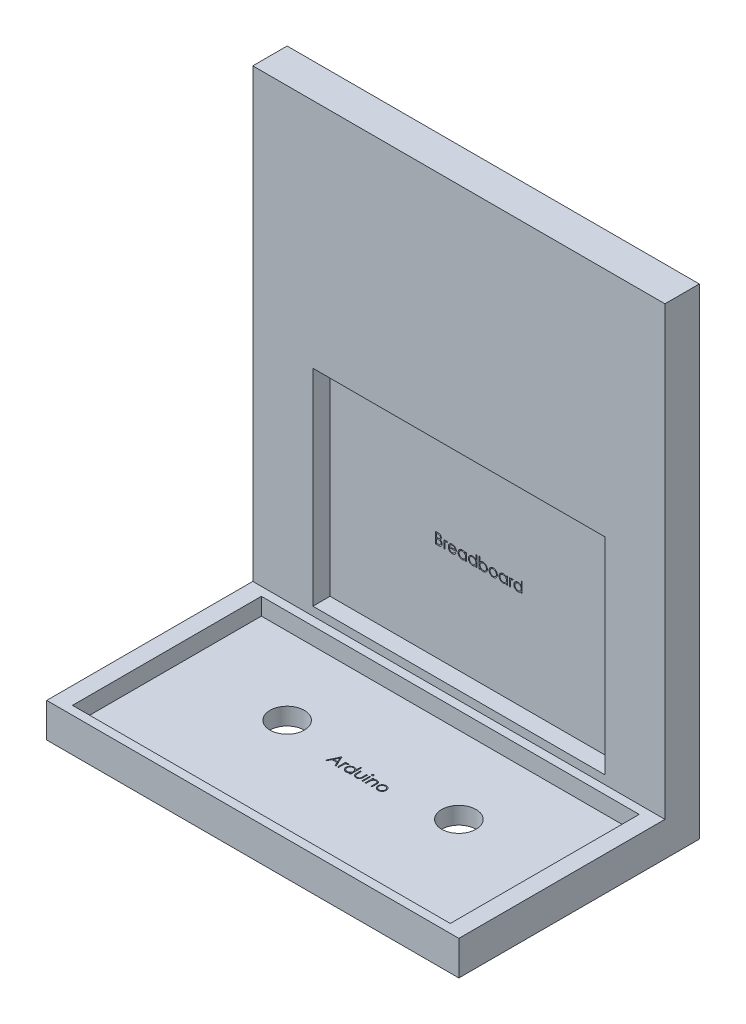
SolidWorks part; units mm, degrees
ref_plane "Front Plane" through (0, 0, 0) normal (0, 0, 1) x (1, 0, 0)
ref_plane "Top Plane" through (0, 0, 0) normal (0, 1, 0) x (1, 0, 0)
ref_plane "Right Plane" through (0, 0, 0) normal (1, 0, 0) x (0, 0, -1)
sketch "Sketch1" plane through (0, 0, 0) normal (0, 0, 1) x (1, 0, 0)
  line L1 (0, 0) -> (120, 0)
  line L2 (0, 0) -> (0, 140)
  line L3 (0, 140) -> (120, 140)
  line L4 (120, 0) -> (120, 140)
  dimension "D1" = 140
  dimension "D2" = 120
extrude "Boss-Extrude1" add sketch "Sketch1" along normal blind 70
sketch "Sketch2" plane through (120, 0, 0) normal (1, 0, 0) x (0, 0, -1)
  line L0 (0, 0) -> (0, 140) construction
  line L1 (-70, 140) -> (-10, 140)
  line L2 (-70, 140) -> (-70, 10)
  line L3 (-70, 10) -> (-10, 10)
  line L4 (-10, 140) -> (-10, 10)
  line L5 (-70, 0) -> (0, 0) construction
  dimension "D1" = 10
  dimension "D2" = 10
extrude "Cut-Extrude1" cut sketch "Sketch2" against normal through all
sketch "Sketch3" plane through (0, 10, 0) normal (0, 1, 0) x (1, 0, 0)
  line L0 (0, -70) -> (120, -70) construction
  line L1 (5, -12.5) -> (115, -12.5)
  line L2 (5, -12.5) -> (5, -67.5)
  line L3 (5, -67.5) -> (115, -67.5)
  line L4 (115, -12.5) -> (115, -67.5)
  line L5 (0, -70) -> (0, -10) construction
  dimension "D1" = 55
  dimension "D2" = 2.5
  dimension "D3" = 110
  dimension "D4" = 5
extrude "Cut-Extrude2" cut sketch "Sketch3" against normal blind 5
sketch "Sketch4" plane through (0, 5, 0) normal (0, 1, 0) x (1, 0, 0)
  text T0 "Arduino"
extrude "Cut-Extrude3" cut sketch "Sketch4" against normal blind 2
sketch "Sketch5" plane through (0, 0, 10) normal (0, 0, 1) x (1, 0, 0)
  line L0 (0, 10) -> (0, 140) construction
  line L1 (17.5, 12.5) -> (102.5, 12.5)
  line L2 (17.5, 12.5) -> (17.5, 72.5)
  line L3 (17.5, 72.5) -> (102.5, 72.5)
  line L4 (102.5, 12.5) -> (102.5, 72.5)
  line L5 (0, 10) -> (120, 10) construction
  dimension "D1" = 60
  dimension "D2" = 85
  dimension "D3" = 17.5
  dimension "D4" = 2.5
extrude "Cut-Extrude4" cut sketch "Sketch5" against normal blind 5
sketch "Sketch7" plane through (0, 0, 5) normal (0, 0, 1) x (1, 0, 0)
  text T0 "Breadboard"
extrude "Cut-Extrude5" cut sketch "Sketch7" against normal blind 2
sketch "Sketch9" plane through (0, 5, 0) normal (0, 1, 0) x (1, 0, 0)
  line L0 (0, -70) -> (0, -10) construction
  line L2 (0, -70) -> (120, -70) construction
  circle A0 centre (35, -35) radius 5
  circle A1 centre (85, -35) radius 5
  dimension "D1" = 10
  dimension "D2" = 50
  dimension "D3" = 35
  dimension "D4" = 35
extrude "Cut-Extrude7" cut sketch "Sketch9" against normal through all
